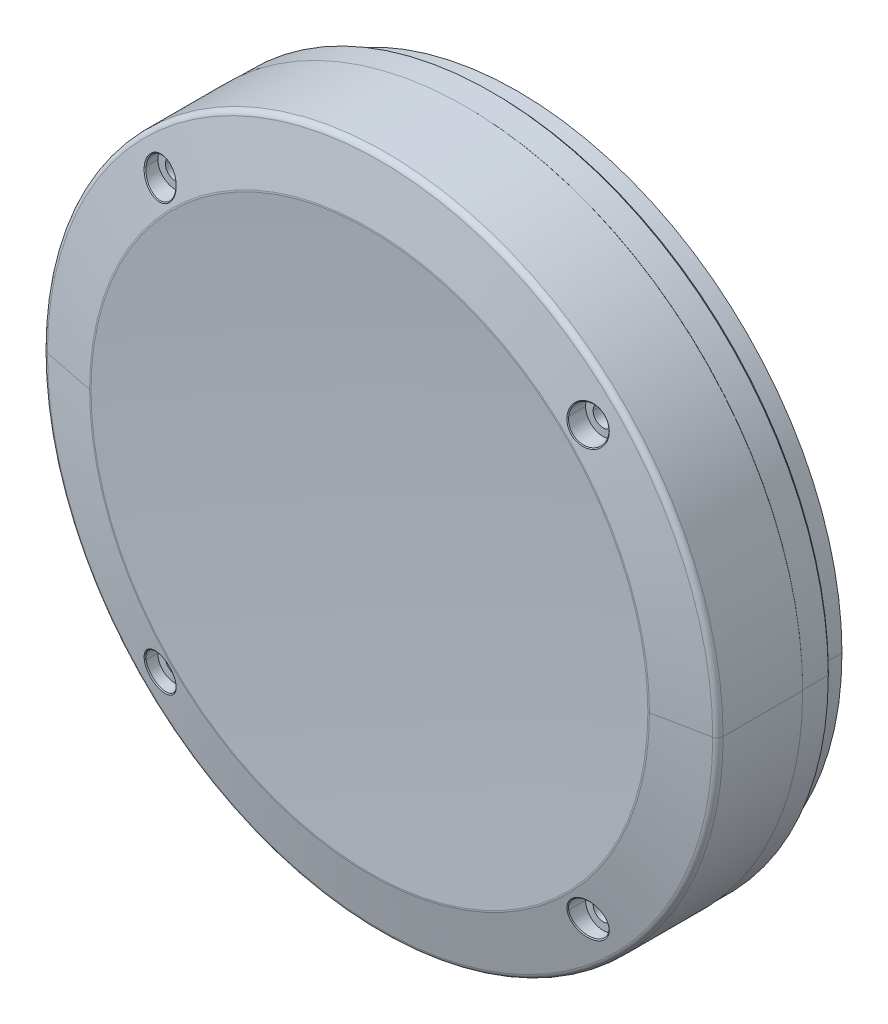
SolidWorks part; units mm, degrees
ref_plane "前视基准面" through (0, 0, 0) normal (0, 0, 1) x (1, 0, 0)
ref_plane "上视基准面" through (0, 0, 0) normal (0, 1, 0) x (1, 0, 0)
ref_plane "右视基准面" through (0, 0, 0) normal (1, 0, 0) x (0, 0, -1)
imported_body "8.0.00.8012658.STEP"
sketch "草图2" plane through (0, 0, 25.5) normal (0, 0, 1) x (1, 0, 0)
  line L0 (-35.1289, -7.4978) -> (-31.1029, -7.4978) construction
  line L1 (-31.1029, -7.4978) -> (-30.6943, -4.9026) construction
  line L2 (-30.6943, -4.9026) -> (-30.1382, -1.3698) construction
  line L3 (-30.1382, -1.3698) -> (-24.9084, -1.3698) construction
  line L4 (-24.9084, -1.3698) -> (-25.1466, -2.8586) construction
  line L5 (-25.1466, -2.8586) -> (-25.8781, -7.4978) construction
  line L6 (-25.8781, -7.4978) -> (-21.8313, -7.4978) construction
  line L7 (-21.8313, -7.4978) -> (-19.4531, 7.5063) construction
  line L8 (-19.4531, 7.5063) -> (-23.5003, 7.5063) construction
  line L9 (25.8241, -7.5156) -> (29.8995, -7.4978)
  line L10 (29.8995, -7.4978) -> (31.7217, 4.0224)
  line L11 (31.7217, 4.0224) -> (34.9295, 4.0224)
  line L12 (34.9295, 4.0224) -> (35.1162, 5.1621)
  line L13 (35.1162, 5.1621) -> (33.3616, 7.5063)
  line L14 (33.3616, 7.5063) -> (24.912, 7.5063)
  line L15 (24.912, 7.5063) -> (24.3389, 4.0224)
  line L16 (24.3389, 4.0224) -> (27.7004, 4.0224)
  line L17 (27.7004, 4.0224) -> (25.8241, -7.5156)
  line L18 (25.8241, -7.5156) -> (29.8995, -7.4978)
  line L19 (29.8995, -7.4978) -> (31.7217, 4.0224)
  line L20 (31.7217, 4.0224) -> (34.9295, 4.0224)
  line L21 (34.9295, 4.0224) -> (35.1162, 5.1621)
  line L22 (35.1162, 5.1621) -> (33.3616, 7.5063)
  line L23 (33.3616, 7.5063) -> (24.912, 7.5063)
  line L24 (24.912, 7.5063) -> (24.3389, 4.0224)
  line L25 (24.3389, 4.0224) -> (27.7004, 4.0224)
  line L26 (27.7004, 4.0224) -> (25.8241, -7.5156)
  line L27 (-23.5003, 7.5063) -> (-24.4126, 1.7152) construction
  line L28 (-24.4126, 1.7152) -> (-29.6586, 1.7152) construction
  line L29 (-29.6586, 1.7152) -> (-29.3947, 3.351) construction
  line L30 (-29.3947, 3.351) -> (-28.7253, 7.5063) construction
  line L31 (-28.7253, 7.5063) -> (-32.7607, 7.5063) construction
  line L32 (-32.7607, 7.5063) -> (-35.1289, -7.4978) construction
  line L33 (-20.6198, -7.4978) -> (-16.531, -7.4978) construction
  line L34 (-16.531, -7.4978) -> (-14.1566, 7.5063) construction
  line L35 (-14.1566, 7.5063) -> (-18.241, 7.5063) construction
  line L36 (-18.241, 7.5063) -> (-20.6198, -7.4978) construction
  line L37 (-0.1078, 7.5063) -> (-12.9818, 7.5063) construction
  line L38 (-12.9818, 7.5063) -> (-13.5555, 4.0224) construction
  line L39 (-13.5555, 4.0224) -> (-11.0726, 4.0224) construction
  line L40 (-11.0726, 4.0224) -> (-12.9039, -7.4962) construction
  line L41 (-12.9039, -7.4962) -> (-8.8727, -7.4978) construction
  line L42 (-8.8727, -7.4978) -> (-7.0501, 4.0224) construction
  line L43 (-7.0501, 4.0224) -> (-4.0626, 4.0224) construction
  line L44 (-4.0626, 4.0224) -> (-5.5783, -5.499) construction
  line L45 (-5.5783, -5.499) -> (-4.0815, -7.4978) construction
  line L46 (-4.0815, -7.4978) -> (-0.9476, -7.4978) construction
  line L47 (-35.1289, -7.4978) -> (-31.1029, -7.4978)
  line L48 (-31.1029, -7.4978) -> (-30.6943, -4.9026)
  line L49 (-30.6943, -4.9026) -> (-30.1382, -1.3698)
  line L50 (-30.1382, -1.3698) -> (-24.9084, -1.3698)
  line L51 (-24.9084, -1.3698) -> (-25.1466, -2.8586)
  line L52 (-25.1466, -2.8586) -> (-25.8781, -7.4978)
  line L53 (-25.8781, -7.4978) -> (-21.8313, -7.4978)
  line L54 (-21.8313, -7.4978) -> (-19.4531, 7.5063)
  line L55 (-19.4531, 7.5063) -> (-23.5003, 7.5063)
  line L56 (-23.5003, 7.5063) -> (-24.4126, 1.7152)
  line L57 (-24.4126, 1.7152) -> (-29.6586, 1.7152)
  line L58 (-29.6586, 1.7152) -> (-29.3947, 3.351)
  line L59 (-29.3947, 3.351) -> (-28.7253, 7.5063)
  line L60 (-28.7253, 7.5063) -> (-32.7607, 7.5063)
  line L61 (-32.7607, 7.5063) -> (-35.1289, -7.4978)
  line L62 (-20.6198, -7.4978) -> (-16.531, -7.4978)
  line L63 (-16.531, -7.4978) -> (-14.1566, 7.5063)
  line L64 (-14.1566, 7.5063) -> (-18.241, 7.5063)
  line L65 (-18.241, 7.5063) -> (-20.6198, -7.4978)
  line L66 (-0.1078, 7.5063) -> (-12.9818, 7.5063)
  line L67 (-12.9818, 7.5063) -> (-13.5555, 4.0224)
  line L68 (-13.5555, 4.0224) -> (-11.0726, 4.0224)
  line L69 (-11.0726, 4.0224) -> (-12.9039, -7.4962)
  line L70 (-12.9039, -7.4962) -> (-8.8727, -7.4978)
  line L71 (-8.8727, -7.4978) -> (-7.0501, 4.0224)
  line L72 (-7.0501, 4.0224) -> (-4.0626, 4.0224)
  line L73 (-4.0626, 4.0224) -> (-5.5783, -5.499)
  line L74 (-5.5783, -5.499) -> (-4.0815, -7.4978)
  line L75 (-4.0815, -7.4978) -> (-0.9476, -7.4978)
  arc A0 (18.4817, -5.4481) -> (13.7092, -5.4772) centre (19.2717, -526.5482) ccw construction
  arc A1 (18.4817, -5.4481) -> (13.7092, -5.4772) centre (19.2717, -526.5482) ccw
  spline S0 degree 3 poles (-2566.3608, 1539.9844) (1847.5228, -621.9763) (-901.2378, -809.9751) (-257.2526, 2948.9581) knots -79.496929 -79.496929 -79.496929 -79.496929 186.239084 186.239084 186.239084 186.239084 weights 1 1 1 1 only from (2.9549, 0.3089) to (5.2818, 1.484) construction
  spline S1 degree 3 poles (-2315.4188, 1884.8188) (143.3598, -687.4009) (1488.9575, -403.3626) (-2647.4347, 1392.6849) knots -108.91223 -108.91223 -108.91223 -108.91223 168.325963 168.325963 168.325963 168.325963 weights 1 1 1 1 only from (5.2818, 1.484) to (6.1272, 3.9392) construction
  spline S2 degree 3 poles (-119.1809, 2593.8462) (-2424.3959, -2732.2377) (2920.3443, 2163.3872) (-2588.1082, -1492.5466) knots -198.652553 -198.652553 -198.652553 -198.652553 173.115383 173.115383 173.115383 173.115383 weights 1 1 1 1 only from (6.1272, 3.9392) to (5.5784, 5.866) construction
  spline S3 degree 3 poles (-2225.7468, -1991.4067) (2816.5329, 1927.5131) (-2986.191, -1017.4619) (1860.3629, -1632.9942) knots -103.866914 -103.866914 -103.866914 -103.866914 262.712884 262.712884 262.712884 262.712884 weights 1 1 1 1 only from (5.5784, 5.866) to (4.0953, 7.086) construction
  spline S4 degree 3 poles (-2058.0278, -2169.7282) (1997.708, 2490.4781) (-1338.0055, -2713.3232) (-436.4881, 2807.3518) knots -141.852457 -141.852457 -141.852457 -141.852457 275.174163 275.174163 275.174163 275.174163 weights 1 1 1 1 only from (4.0953, 7.086) to (2.6927, 7.4154) construction
  spline S5 degree 3 poles (-1841.4606, 1611.6155) (-2872.6705, -1135.5815) (3567.0542, 748.0927) (-2964.6959, -446.5758) knots -183.968062 -183.968062 -183.968062 -183.968062 136.636924 136.636924 136.636924 136.636924 weights 1 1 1 1 only from (2.6927, 7.4154) to (-0.1078, 7.5063) construction
  spline S6 degree 3 poles (-2946.2437, 558.8956) (3561.3052, -883.5121) (-2830.8725, 1208.9153) (-2149.3906, -1323.571) knots -85.825272 -85.825272 -85.825272 -85.825272 213.288569 213.288569 213.288569 213.288569 weights 1 1 1 1 only from (-0.9476, -7.4978) to (2.3471, -7.3232) construction
  spline S7 degree 3 poles (75.9677, 2930.3993) (-1238.5529, -2156.602) (2184.1304, 1355.5474) (-2906.9843, -586.7676) knots -161.429444 -161.429444 -161.429444 -161.429444 177.768129 177.768129 177.768129 177.768129 weights 1 1 1 1 only from (2.3471, -7.3232) to (3.9907, -6.7397) construction
  spline S8 degree 3 poles (-1675.3939, 2473.5605) (1677.8306, -3194.0093) (-1105.5141, 3560.5162) (-613.3602, -2758.8447) knots -125.48733 -125.48733 -125.48733 -125.48733 231.059214 231.059214 231.059214 231.059214 weights 1 1 1 1 only from (3.9907, -6.7397) to (5.3893, -5.2138) construction
  spline S9 degree 3 poles (-2954.132, -449.4273) (2028.3065, 816.8848) (-690.873, -1532.2325) (-1113.1927, 2707.8529) knots -149.456813 -149.456813 -149.456813 -149.456813 190.286535 190.286535 190.286535 190.286535 weights 1 1 1 1 only from (5.3893, -5.2138) to (5.8965, -3.0905) construction
  spline S10 degree 3 poles (-2927.1463, -246.5308) (1138.8704, -1005.9772) (419.1822, 1865.7606) (-1727.8081, -2422.2511) knots -140.697677 -140.697677 -140.697677 -140.697677 134.95649 134.95649 134.95649 134.95649 weights 1 1 1 1 only from (5.8965, -3.0905) to (5.1448, -0.8315) construction
  spline S11 degree 3 poles (-2828.981, -840.5761) (1252.0511, -636.7793) (209.6272, 1748.6166) (-1517.6158, -2561.6626) knots -145.368212 -145.368212 -145.368212 -145.368212 133.339244 133.339244 133.339244 133.339244 weights 1 1 1 1 only from (5.1448, -0.8315) to (2.9549, 0.3089) construction
  spline S12 degree 3 poles (2698.4903, 1320.5985) (-2540.9289, -1572.2451) (2563.1607, 1565.9515) (-2677.0795, -1325.7329) knots 9.296295 9.296295 9.296295 9.296295 178.093239 178.093239 178.093239 178.093239 weights 1 1 1 1 only from (11.6967, -4.2382) to (9.4846, -0.2529) construction
  spline S13 degree 3 poles (1488.3923, -2609.5065) (-1337.9095, 2655.9954) (1214.3478, -2721.7452) (-1041.84, 2808.5678) knots 40.938987 40.938987 40.938987 40.938987 145.051334 145.051334 145.051334 145.051334 weights 1 1 1 1 only from (9.4846, -0.2529) to (9.506, 0.266) construction
  spline S14 degree 3 poles (2491.0231, -1674.9873) (-2638.2581, 1395.0975) (2658.9376, -1392.4562) (-2475.3151, 1672.0643) knots 9.316865 9.316865 9.316865 9.316865 169.911431 169.911431 169.911431 169.911431 weights 1 1 1 1 only from (9.506, 0.266) to (12.3024, 5.0501) construction
  spline S15 degree 3 poles (-1621.9326, -2509.1618) (1779.3083, 2385.6505) (-1916.9616, -2241.262) (2138.3403, 2119.4619) knots 41.545924 41.545924 41.545924 41.545924 137.16789 137.16789 137.16789 137.16789 weights 1 1 1 1 only from (12.3024, 5.0501) to (12.9927, 5.4336) construction
  spline S16 degree 3 poles (-369.8695, 2976.5866) (118.1142, -2964.469) (-88.5714, 2974.5767) (413.065, -2963.5978) knots -7.7443 -7.7443 -7.7443 -7.7443 182.461809 182.461809 182.461809 182.461809 weights 1 1 1 1 only from (12.9927, 5.4336) to (17.1413, 5.4126) construction
  spline S17 degree 3 poles (1235.5229, -2735.9559) (-1201.2076, 2751.3671) (1224.963, -2745.1326) (-1169.5726, 2760.553) knots 29.300877 29.300877 29.300877 29.300877 138.845601 138.845601 138.845601 138.845601 weights 1 1 1 1 only from (17.1413, 5.4126) to (17.3814, 5.5096) construction
  spline S18 degree 3 poles (-1230.7833, -2722.446) (1209.5375, 2618.5262) (-1183.7602, -2604.0351) (1292.7011, 2723.3905) knots 2.989527 2.989527 2.989527 2.989527 161.436184 161.436184 161.436184 161.436184 weights 1 1 1 1 only from (17.3814, 5.5096) to (18.5274, 7.4671) construction
  spline S19 degree 3 poles (2911.0041, 803.0559) (-2852.994, -818.6094) (2880.5996, 863.8797) (-2847.716, -878.9859) knots 9.410109 9.410109 9.410109 9.410109 154.679293 154.679293 154.679293 154.679293 weights 1 1 1 1 only from (18.5274, 7.4671) to (18.2466, 7.4853) construction
  spline S20 degree 3 poles (60.4686, -2984.6817) (342.2198, 3000.2287) (-305.6595, -2985.2889) (-37.3807, 2999.7298) knots -0.341981 -0.341981 -0.341981 -0.341981 158.319278 158.319278 158.319278 158.319278 weights 1 1 1 1 only from (18.2466, 7.4853) to (11.8094, 7.4914) construction
  spline S21 degree 3 poles (2860.4086, 943.1996) (-2729.5263, -1108.9841) (2663.3747, 1319.6854) (-2571.026, -1516.3797) knots 29.89182 29.89182 29.89182 29.89182 125.730802 125.730802 125.730802 125.730802 weights 1 1 1 1 only from (11.8094, 7.4914) to (11.1726, 7.1256) construction
  spline S22 degree 3 poles (-2692.8678, 1072.3431) (3425.3921, 127.9048) (-3546.6795, -419.7182) (2880.5397, -570.5262) knots -140.481268 -140.481268 -140.481268 -140.481268 319.688909 319.688909 319.688909 319.688909 weights 1 1 1 1 only from (11.1726, 7.1256) to (7.1844, 0.3226) construction
  spline S23 degree 3 poles (-12.1669, 2998.5739) (233.4204, -2954.3503) (-422.1943, 2932.4852) (635.1873, -2932.2949) knots 23.076667 23.076667 23.076667 23.076667 124.380409 124.380409 124.380409 124.380409 weights 1 1 1 1 only from (7.1844, 0.3226) to (7.1755, -0.303) construction
  spline S24 degree 3 poles (-2693.1727, -1237.029) (2348.7398, 1879.5075) (-2318.1813, -1907.2005) (2708.727, 1228.6971) knots -54.692035 -54.692035 -54.692035 -54.692035 202.917243 202.917243 202.917243 202.917243 weights 1 1 1 1 only from (7.1755, -0.303) to (11.1115, -7.3103) construction
  spline S25 degree 3 poles (-2378.1621, 1805.6211) (2465.8121, -1698.1345) (-2519.6905, 1566.4023) (2629.7401, -1470.0788) knots 16.549414 16.549414 16.549414 16.549414 124.211606 124.211606 124.211606 124.211606 weights 1 1 1 1 only from (11.1115, -7.3103) to (11.4102, -7.4857) construction
  spline S26 degree 3 poles (-446.705, -2970.7891) (309.9813, 2955.8928) (-286.1177, -2970.38) (480.426, 2954.3869) knots -18.124439 -18.124439 -18.124439 -18.124439 155.708082 155.708082 155.708082 155.708082 weights 1 1 1 1 only from (11.4102, -7.4857) to (14.0187, -7.4849) construction
  spline S27 degree 3 poles (30.2769, 2978.9792) (-494.7153, -2993.7849) (522.653, 2978.7928) (12.8483, -2993.8892) knots -57.026785 -57.026785 -57.026785 -57.026785 189.719307 189.719307 189.719307 189.719307 weights 1 1 1 1 only from (14.0187, -7.4849) to (19.5688, -7.4897) construction
  spline S28 degree 3 poles (-1628.7606, -2512.8493) (1534.5142, 2562.7833) (-1381.3577, -2642.7382) (1325.8697, 2692.7963) knots 6.591043 6.591043 6.591043 6.591043 121.260454 121.260454 121.260454 121.260454 weights 1 1 1 1 only from (19.5688, -7.4897) to (19.9071, -7.3087) construction
  spline S29 degree 3 poles (1109.9158, -2769.3629) (-1512.9191, 1949.4206) (1528.3723, -1951.5004) (-949.2059, 2798.6149) knots -96.373997 -96.373997 -96.373997 -96.373997 225.79148 225.79148 225.79148 225.79148 weights 1 1 1 1 only from (19.9071, -7.3087) to (24.0633, -0.2157) construction
  spline S30 degree 3 poles (-10.7823, -2998.4095) (-139.7035, 2963.6364) (383.0358, -2946.9498) (-526.2249, 2947.7914) knots -0.566965 -0.566965 -0.566965 -0.566965 122.373319 122.373319 122.373319 122.373319 weights 1 1 1 1 only from (24.0633, -0.2157) to (24.0662, 0.1989) construction
  spline S31 degree 3 poles (2676.9515, 1387.4227) (-2464.3189, -1681.7297) (2508.7459, 1688.9177) (-2628.3815, -1388.3365) knots -22.310822 -22.310822 -22.310822 -22.310822 140.922769 140.922769 140.922769 140.922769 weights 1 1 1 1 only from (24.0662, 0.1989) to (21.2713, 5.1855) construction
  spline S32 degree 3 poles (2803.2022, 1127.6785) (-2745.1468, -1143.1943) (2792.1382, 1142.1204) (-2775.1248, -1080.921) knots 5.450534 5.450534 5.450534 5.450534 108.693622 108.693622 108.693622 108.693622 weights 1 1 1 1 only from (21.2713, 5.1855) to (20.6696, 6.1925) construction
  spline S33 degree 3 poles (2476.3952, 1728.6463) (-2397.8649, -1580.3634) (2460.2896, 1554.5017) (-2505.9455, -1614.5206) knots -21.53227 -21.53227 -21.53227 -21.53227 134.266479 134.266479 134.266479 134.266479 weights 1 1 1 1 only from (20.6696, 6.1925) to (19.5712, 4.3268) construction
  spline S34 degree 3 poles (2262.2922, 1996.3837) (-2168.0913, -2038.1771) (2142.8622, 2111.9333) (-2029.7514, -2186.2218) knots 1.038591 1.038591 1.038591 1.038591 108.667619 108.667619 108.667619 108.667619 weights 1 1 1 1 only from (19.5712, 4.3268) to (19.5975, 3.9448) construction
  spline S35 degree 3 poles (-2111.6234, -2084.5888) (1865.4681, 2587.5473) (-1783.5372, -2632.4878) (2059.8439, 2183.9395) knots -121.800974 -121.800974 -121.800974 -121.800974 232.37933 232.37933 232.37933 232.37933 weights 1 1 1 1 only from (19.5975, 3.9448) to (21.6569, 0.2717) construction
  spline S36 degree 3 poles (2860.8853, 968.8022) (-2824.7474, -956.2887) (2868.2583, 956.3877) (-2817.8738, -967.4189) knots 10.053252 10.053252 10.053252 10.053252 89.102873 89.102873 89.102873 89.102873 weights 1 1 1 1 only from (21.6569, 0.2717) to (21.7304, -0.1938) construction
  spline S37 degree 3 poles (2768.6145, -1181.7914) (-2512.2063, 1544.7679) (2550.5157, -1553.3704) (-2729.2605, 1172.7818) knots -50.916119 -50.916119 -50.916119 -50.916119 148.85366 148.85366 148.85366 148.85366 weights 1 1 1 1 only from (21.7304, -0.1938) to (18.7384, -5.2865) construction
  spline S38 degree 3 poles (2991.2991, -405.9687) (-2929.6256, 500.285) (2950.8345, -601.3092) (-2904.9033, 666.9546) knots -14.70065 -14.70065 -14.70065 -14.70065 105.706777 105.706777 105.706777 105.706777 weights 1 1 1 1 only from (18.7384, -5.2865) to (18.4817, -5.4481) construction
  spline S39 degree 3 poles (2975.8301, 468.9461) (-2965.2318, -440.4255) (2999.7546, 374.9308) (-2970.1866, -313.3698) knots 3.768774 3.768774 3.768774 3.768774 84.61413 84.61413 84.61413 84.61413 weights 1 1 1 1 only from (13.7092, -5.4772) to (13.5884, -5.2186) construction
  spline S40 degree 3 poles (1326.4455, -2698.5126) (-1468.9238, 2443.7669) (1523.8597, -2442.6039) (-1386.2755, 2647.148) knots -99.446964 -99.446964 -99.446964 -99.446964 178.556941 178.556941 178.556941 178.556941 weights 1 1 1 1 only from (13.5884, -5.2186) to (14.9478, -2.9483) construction
  spline S41 degree 3 poles (-2399.2495, -1781.4861) (2512.9036, 1604.486) (-2580.9134, -1445.9049) (2724.0055, 1283.3166) knots -25.640128 -25.640128 -25.640128 -25.640128 104.315361 104.315361 104.315361 104.315361 weights 1 1 1 1 only from (14.9478, -2.9483) to (15.2626, -2.7713) construction
  spline S42 degree 3 poles (-47.3669, 2996.099) (-9.8112, -3002.0074) (41.7992, 2996.4547) (79.6365, -3001.6218) knots -37.907383 -37.907383 -37.907383 -37.907383 112.673045 112.673045 112.673045 112.673045 weights 1 1 1 1 only from (15.2626, -2.7713) to (16.8871, -2.7753) construction
  spline S43 degree 3 poles (-2705.7949, -1258.0069) (2611.9474, 1429.756) (-2466.4108, -1620.8908) (2405.8922, 1809.5167) knots -28.464249 -28.464249 -28.464249 -28.464249 99.55354 99.55354 99.55354 99.55354 weights 1 1 1 1 only from (16.8871, -2.7753) to (17.2492, -2.57) construction
  spline S44 degree 3 poles (2890.0619, -844.6437) (-3031.5188, 530.1495) (3083.9599, -486.6774) (-2885.247, 734.3014) knots -128.060039 -128.060039 -128.060039 -128.060039 201.679521 201.679521 201.679521 201.679521 weights 1 1 1 1 only from (17.2492, -2.57) to (18.6345, -0.2052) construction
  spline S45 degree 3 poles (-545.143, -2944.9911) (368.6888, 2943.7381) (-114.8763, -2960.9954) (-66.7261, 2997.0726) knots -31.620307 -31.620307 -31.620307 -31.620307 95.864619 95.864619 95.864619 95.864619 weights 1 1 1 1 only from (18.6345, -0.2052) to (18.6292, 0.2111) construction
  spline S46 degree 3 poles (2585.7836, 1551.8712) (-2513.4619, -1615.0569) (2550.181, 1616.3773) (-2549.8757, -1548.879) knots -33.9358 -33.9358 -33.9358 -33.9358 94.099509 94.099509 94.099509 94.099509 weights 1 1 1 1 only from (18.6292, 0.2111) to (17.844, 1.5996) construction
  spline S47 degree 3 poles (1734.4218, -2458.0024) (-1585.5842, 2517.4361) (1496.9245, -2587.1023) (-1325.5253, 2683.2003) knots -27.914597 -27.914597 -27.914597 -27.914597 86.471802 86.471802 86.471802 86.471802 weights 1 1 1 1 only from (17.844, 1.5996) to (17.8558, 2.0102) construction
  spline S48 degree 3 poles (-2506.5773, 1621.5026) (2487.3312, -1711.7188) (-2450.0705, 1718.3082) (2541.2869, -1618.9969) knots -46.182347 -46.182347 -46.182347 -46.182347 98.896074 98.896074 98.896074 98.896074 weights 1 1 1 1 only from (17.8558, 2.0102) to (18.9089, 3.7921) construction
  spline S49 degree 3 poles (-87.4736, -2991.5521) (-142.0349, 2949.8832) (440.2665, -2917.1615) (-655.3119, 2925.0982) knots -38.128736 -38.128736 -38.128736 -38.128736 86.724966 86.724966 86.724966 86.724966 weights 1 1 1 1 only from (18.9089, 3.7921) to (18.9355, 4.3506) construction
  spline S50 degree 3 poles (2009.9454, 2248.3216) (-1960.9477, -2265.4362) (1992.4731, 2280.1467) (-1953.8588, -2255.1581) knots -8.665517 -8.665517 -8.665517 -8.665517 53.788959 53.788959 53.788959 53.788959 weights 1 1 1 1 only from (18.9355, 4.3506) to (18.5933, 5.1241) construction
  spline S51 degree 3 poles (-1128.9978, -2766.5952) (1183.5824, 2784.1149) (-1142.9349, -2775.8306) (1151.4231, 2782.5241) knots -13.254973 -13.254973 -13.254973 -13.254973 55.848382 55.848382 55.848382 55.848382 weights 1 1 1 1 only from (18.5933, 5.1241) to (17.7422, 5.042) construction
  spline S52 degree 3 poles (2670.1028, 1401.4641) (-2467.5332, -1588.0623) (2357.1685, 1805.4908) (-2198.8295, -2013.8534) knots -45.597381 -45.597381 -45.597381 -45.597381 83.584228 83.584228 83.584228 83.584228 weights 1 1 1 1 only from (17.7422, 5.042) to (17.2924, 4.7515) construction
  spline S53 degree 3 poles (-2545.8755, 1562.2159) (2634.1695, -1461.6749) (-2601.6438, 1467.6892) (2582.0293, -1550.2062) knots -52.852138 -52.852138 -52.852138 -52.852138 87.748818 87.748818 87.748818 87.748818 weights 1 1 1 1 only from (17.2924, 4.7515) to (16.2531, 2.9615) construction
  spline S54 degree 3 poles (2936.8758, 680.9892) (-2917.9653, -470.5617) (2975.813, 291.3396) (-2980.5039, -119.8183) knots -44.689591 -44.689591 -44.689591 -44.689591 74.091163 74.091163 74.091163 74.091163 weights 1 1 1 1 only from (16.2531, 2.9615) to (15.8752, 2.7392) construction
  spline S55 degree 3 poles (38.6351, -2996.8482) (59.5633, 3002.7142) (-29.2537, -2997.2247) (-8.4687, 3002.3333) knots -46.864294 -46.864294 -46.864294 -46.864294 74.18265 74.18265 74.18265 74.18265 weights 1 1 1 1 only from (15.8752, 2.7392) to (14.3376, 2.7513) construction
  spline S56 degree 3 poles (2881.3382, 879.7981) (-2747.1562, -1067.9463) (2685.1953, 1280.1558) (-2583.2379, -1495.1089) knots -46.942227 -46.942227 -46.942227 -46.942227 71.176681 71.176681 71.176681 71.176681 weights 1 1 1 1 only from (14.3376, 2.7513) to (13.9043, 2.5105) construction
  spline S57 degree 3 poles (2589.5429, -1529.5341) (-2446.5236, 1738.6741) (2478.4301, -1726.7201) (-2567.2523, 1525.6973) knots -113.829442 -113.829442 -113.829442 -113.829442 129.724782 129.724782 129.724782 129.724782 weights 1 1 1 1 only from (13.9043, 2.5105) to (12.5635, 0.2248) construction
  spline S58 degree 3 poles (1159.513, 2770.7221) (-939.9309, -2809.1192) (760.0812, 2868.5042) (-519.7122, -2950.5634) knots -50.128435 -50.128435 -50.128435 -50.128435 67.944348 67.944348 67.944348 67.944348 weights 1 1 1 1 only from (12.5635, 0.2248) to (12.5651, -0.2739) construction
  spline S59 degree 3 poles (-2560.7506, -1541.8195) (2552.1161, 1602.8089) (-2526.4228, -1604.3228) (2586.9822, 1539.1996) knots -56.60861 -56.60861 -56.60861 -56.60861 69.228196 69.228196 69.228196 69.228196 weights 1 1 1 1 only from (12.5651, -0.2739) to (13.3342, -1.6365) construction
  spline S60 degree 3 poles (-2106.8906, 2120.2803) (2065.0033, -2178.0237) (-1958.7222, 2245.0682) (1894.3494, -2338.1597) knots -49.024981 -49.024981 -49.024981 -49.024981 60.37931 60.37931 60.37931 60.37931 weights 1 1 1 1 only from (13.3342, -1.6365) to (13.3168, -2.0463) construction
  spline S61 degree 3 poles (2629.3512, -1468.7767) (-2546.09, 1564.0902) (2571.1033, -1571.0209) (-2602.0013, 1466.0092) knots -93.089116 -93.089116 -93.089116 -93.089116 99.04582 99.04582 99.04582 99.04582 weights 1 1 1 1 only from (13.3168, -2.0463) to (12.4976, -3.4712) construction
  spline S62 degree 3 poles (-2025.9198, 2196.5748) (2105.7693, -2106.3037) (-2076.5425, 2102.6556) (2035.4583, -2218.1218) knots -137.433862 -137.433862 -137.433862 -137.433862 139.550836 139.550836 139.550836 139.550836 weights 1 1 1 1 only from (12.4976, -3.4712) to (11.9012, -4.4896) construction
  spline S63 degree 3 poles (2714.402, 1297.7184) (-2680.4595, -1327.4297) (2698.5588, 1329.6914) (-2674.9255, -1338.7969) knots 44.173622 44.173622 44.173622 44.173622 148.719237 148.719237 148.719237 148.719237 weights 1 1 1 1 only from (11.9012, -4.4896) to (11.6967, -4.2382) construction
  spline S64 degree 3 poles (2.9549, 0.3089) (3.9422, 0.4454) (4.7148, 0.8366) (5.2818, 1.484) knots 40.100612 40.100612 40.100612 40.100612 42.6069 42.6069 42.6069 42.6069 weights 1 1 1 1
  spline S65 degree 3 poles (5.2818, 1.484) (5.8443, 2.1274) (6.1272, 2.9461) (6.1272, 3.9392) knots 37.594324 37.594324 37.594324 37.594324 40.100612 40.100612 40.100612 40.100612 weights 1 1 1 1
  spline S66 degree 3 poles (6.1272, 3.9392) (6.1272, 4.6553) (5.9462, 5.2995) (5.5784, 5.866) knots 35.088035 35.088035 35.088035 35.088035 37.594324 37.594324 37.594324 37.594324 weights 1 1 1 1
  spline S67 degree 3 poles (5.5784, 5.866) (5.2147, 6.4326) (4.7181, 6.8383) (4.0953, 7.086) knots 32.581747 32.581747 32.581747 32.581747 35.088035 35.088035 35.088035 35.088035 weights 1 1 1 1
  spline S68 degree 3 poles (4.0953, 7.086) (3.7207, 7.244) (3.2523, 7.3523) (2.6927, 7.4154) knots 30.075459 30.075459 30.075459 30.075459 32.581747 32.581747 32.581747 32.581747 weights 1 1 1 1
  spline S69 degree 3 poles (2.6927, 7.4154) (2.1301, 7.4748) (1.1999, 7.5063) (-0.1078, 7.5063) knots 27.569171 27.569171 27.569171 27.569171 30.075459 30.075459 30.075459 30.075459 weights 1 1 1 1
  spline S70 degree 3 poles (-0.9476, -7.4978) (0.5913, -7.4978) (1.6856, -7.438) (2.3471, -7.3232) knots 12.531441 12.531441 12.531441 12.531441 15.037729 15.037729 15.037729 15.037729 weights 1 1 1 1
  spline S71 degree 3 poles (2.3471, -7.3232) (3.0038, -7.2084) (3.5534, -7.0121) (3.9907, -6.7397) knots 10.025153 10.025153 10.025153 10.025153 12.531441 12.531441 12.531441 12.531441 weights 1 1 1 1
  spline S72 degree 3 poles (3.9907, -6.7397) (4.5855, -6.3719) (5.0506, -5.8603) (5.3893, -5.2138) knots 7.518865 7.518865 7.518865 7.518865 10.025153 10.025153 10.025153 10.025153 weights 1 1 1 1
  spline S73 degree 3 poles (5.3893, -5.2138) (5.7288, -4.5631) (5.8965, -3.8567) (5.8965, -3.0905) knots 5.012576 5.012576 5.012576 5.012576 7.518865 7.518865 7.518865 7.518865 weights 1 1 1 1
  spline S74 degree 3 poles (5.8965, -3.0905) (5.8965, -2.1716) (5.6451, -1.4159) (5.1448, -0.8315) knots 2.506288 2.506288 2.506288 2.506288 5.012576 5.012576 5.012576 5.012576 weights 1 1 1 1
  spline S75 degree 3 poles (5.1448, -0.8315) (4.6409, -0.2512) (3.9099, 0.131) (2.9549, 0.3089) knots 0 0 0 0 2.506288 2.506288 2.506288 2.506288 weights 1 1 1 1
  spline S76 degree 3 poles (11.6967, -4.2382) (10.96, -2.9095) (10.2314, -1.5759) (9.4846, -0.2529) knots 93.128833 93.128833 93.128833 93.128833 94.954889 94.954889 94.954889 94.954889 weights 1 1 1 1
  spline S77 degree 3 poles (9.4846, -0.2529) (9.3714, -0.0516) (9.3969, 0.0826) (9.506, 0.266) knots 91.302777 91.302777 91.302777 91.302777 93.128833 93.128833 93.128833 93.128833 weights 1 1 1 1
  spline S78 degree 3 poles (9.506, 0.266) (10.4464, 1.8566) (11.3887, 3.4456) (12.3024, 5.0501) knots 89.476722 89.476722 89.476722 89.476722 91.302777 91.302777 91.302777 91.302777 weights 1 1 1 1
  spline S79 degree 3 poles (12.3024, 5.0501) (12.4754, 5.3528) (12.671, 5.4377) (12.9927, 5.4336) knots 87.650666 87.650666 87.650666 87.650666 89.476722 89.476722 89.476722 89.476722 weights 1 1 1 1
  spline S80 degree 3 poles (12.9927, 5.4336) (14.3756, 5.4158) (15.758, 5.4158) (17.1413, 5.4126) knots 85.824611 85.824611 85.824611 85.824611 87.650666 87.650666 87.650666 87.650666 weights 1 1 1 1
  spline S81 degree 3 poles (17.1413, 5.4126) (17.2286, 5.4126) (17.3235, 5.411) (17.3814, 5.5096) knots 83.998555 83.998555 83.998555 83.998555 85.824611 85.824611 85.824611 85.824611 weights 1 1 1 1
  spline S82 degree 3 poles (17.3814, 5.5096) (17.7564, 6.1529) (18.1334, 6.7947) (18.5274, 7.4671) knots 82.1725 82.1725 82.1725 82.1725 83.998555 83.998555 83.998555 83.998555 weights 1 1 1 1
  spline S83 degree 3 poles (18.5274, 7.4671) (18.4038, 7.4748) (18.3253, 7.4853) (18.2466, 7.4853) knots 80.346444 80.346444 80.346444 80.346444 82.1725 82.1725 82.1725 82.1725 weights 1 1 1 1
  spline S84 degree 3 poles (18.2466, 7.4853) (16.1015, 7.4845) (13.9549, 7.4744) (11.8094, 7.4914) knots 78.520389 78.520389 78.520389 78.520389 80.346444 80.346444 80.346444 80.346444 weights 1 1 1 1
  spline S85 degree 3 poles (11.8094, 7.4914) (11.491, 7.493) (11.3285, 7.3935) (11.1726, 7.1256) knots 76.694333 76.694333 76.694333 76.694333 78.520389 78.520389 78.520389 78.520389 weights 1 1 1 1
  spline S86 degree 3 poles (11.1726, 7.1256) (9.8535, 4.8517) (8.5236, 2.584) (7.1844, 0.3226) knots 74.868278 74.868278 74.868278 74.868278 76.694333 76.694333 76.694333 76.694333 weights 1 1 1 1
  spline S87 degree 3 poles (7.1844, 0.3226) (7.0502, 0.0939) (7.0421, -0.0686) (7.1755, -0.303) knots 73.042222 73.042222 73.042222 73.042222 74.868278 74.868278 74.868278 74.868278 weights 1 1 1 1
  spline S88 degree 3 poles (7.1755, -0.303) (8.4965, -2.6331) (9.8063, -4.9705) (11.1115, -7.3103) knots 71.216166 71.216166 71.216166 71.216166 73.042222 73.042222 73.042222 73.042222 weights 1 1 1 1
  spline S89 degree 3 poles (11.1115, -7.3103) (11.1875, -7.4493) (11.2546, -7.4865) (11.4102, -7.4857) knots 69.390111 69.390111 69.390111 69.390111 71.216166 71.216166 71.216166 71.216166 weights 1 1 1 1
  spline S90 degree 3 poles (11.4102, -7.4857) (12.2802, -7.476) (13.1487, -7.4849) (14.0187, -7.4849) knots 67.564055 67.564055 67.564055 67.564055 69.390111 69.390111 69.390111 69.390111 weights 1 1 1 1
  spline S91 degree 3 poles (14.0187, -7.4849) (15.8683, -7.4865) (17.7188, -7.4849) (19.5688, -7.4897) knots 65.738 65.738 65.738 65.738 67.564055 67.564055 67.564055 67.564055 weights 1 1 1 1
  spline S92 degree 3 poles (19.5688, -7.4897) (19.724, -7.4897) (19.821, -7.4574) (19.9071, -7.3087) knots 63.911944 63.911944 63.911944 63.911944 65.738 65.738 65.738 65.738 weights 1 1 1 1
  spline S93 degree 3 poles (19.9071, -7.3087) (21.2879, -4.9414) (22.674, -2.5781) (24.0633, -0.2157) knots 62.085889 62.085889 62.085889 62.085889 63.911944 63.911944 63.911944 63.911944 weights 1 1 1 1
  spline S94 degree 3 poles (24.0633, -0.2157) (24.1502, -0.0686) (24.1535, 0.0438) (24.0662, 0.1989) knots 60.259833 60.259833 60.259833 60.259833 62.085889 62.085889 62.085889 62.085889 weights 1 1 1 1
  spline S95 degree 3 poles (24.0662, 0.1989) (23.1302, 1.859) (22.2081, 3.5272) (21.2713, 5.1855) knots 58.433778 58.433778 58.433778 58.433778 60.259833 60.259833 60.259833 60.259833 weights 1 1 1 1
  spline S96 degree 3 poles (21.2713, 5.1855) (21.0834, 5.5177) (20.9238, 5.8701) (20.6696, 6.1925) knots 56.607722 56.607722 56.607722 56.607722 58.433778 58.433778 58.433778 58.433778 weights 1 1 1 1
  spline S97 degree 3 poles (20.6696, 6.1925) (20.293, 5.55) (19.9373, 4.9349) (19.5712, 4.3268) knots 54.781666 54.781666 54.781666 54.781666 56.607722 56.607722 56.607722 56.607722 weights 1 1 1 1
  spline S98 degree 3 poles (19.5712, 4.3268) (19.4835, 4.1801) (19.5203, 4.0798) (19.5975, 3.9448) knots 52.955611 52.955611 52.955611 52.955611 54.781666 54.781666 54.781666 54.781666 weights 1 1 1 1
  spline S99 degree 3 poles (19.5975, 3.9448) (20.2897, 2.7239) (20.9755, 1.4986) (21.6569, 0.2717) knots 51.129555 51.129555 51.129555 51.129555 52.955611 52.955611 52.955611 52.955611 weights 1 1 1 1
  spline S100 degree 3 poles (21.6569, 0.2717) (21.7328, 0.1335) (21.8508, 0.0098) (21.7304, -0.1938) knots 49.3035 49.3035 49.3035 49.3035 51.129555 51.129555 51.129555 51.129555 weights 1 1 1 1
  spline S101 degree 3 poles (21.7304, -0.1938) (20.7254, -1.8871) (19.7333, -3.5876) (18.7384, -5.2865) knots 47.477444 47.477444 47.477444 47.477444 49.3035 49.3035 49.3035 49.3035 weights 1 1 1 1
  spline S102 degree 3 poles (18.7384, -5.2865) (18.6794, -5.3883) (18.6212, -5.4473) (18.4817, -5.4481) knots 45.651389 45.651389 45.651389 45.651389 47.477444 47.477444 47.477444 47.477444 weights 1 1 1 1
  spline S103 degree 3 poles (13.7092, -5.4772) (13.438, -5.4797) (13.4893, -5.3811) (13.5884, -5.2186) knots 41.999278 41.999278 41.999278 41.999278 43.825333 43.825333 43.825333 43.825333 weights 1 1 1 1
  spline S104 degree 3 poles (13.5884, -5.2186) (14.0462, -4.4645) (14.5004, -3.7096) (14.9478, -2.9483) knots 40.173222 40.173222 40.173222 40.173222 41.999278 41.999278 41.999278 41.999278 weights 1 1 1 1
  spline S105 degree 3 poles (14.9478, -2.9483) (15.0258, -2.8174) (15.1118, -2.7697) (15.2626, -2.7713) knots 38.347167 38.347167 38.347167 38.347167 40.173222 40.173222 40.173222 40.173222 weights 1 1 1 1
  spline S106 degree 3 poles (15.2626, -2.7713) (15.8041, -2.7786) (16.3456, -2.7656) (16.8871, -2.7753) knots 36.521111 36.521111 36.521111 36.521111 38.347167 38.347167 38.347167 38.347167 weights 1 1 1 1
  spline S107 degree 3 poles (16.8871, -2.7753) (17.0609, -2.7778) (17.1619, -2.7212) (17.2492, -2.57) knots 34.695055 34.695055 34.695055 34.695055 36.521111 36.521111 36.521111 36.521111 weights 1 1 1 1
  spline S108 degree 3 poles (17.2492, -2.57) (17.7042, -1.778) (18.1673, -0.9899) (18.6345, -0.2052) knots 32.869 32.869 32.869 32.869 34.695055 34.695055 34.695055 34.695055 weights 1 1 1 1
  spline S109 degree 3 poles (18.6345, -0.2052) (18.723, -0.0556) (18.7194, 0.0599) (18.6292, 0.2111) knots 31.042944 31.042944 31.042944 31.042944 32.869 32.869 32.869 32.869 weights 1 1 1 1
  spline S110 degree 3 poles (18.6292, 0.2111) (18.3593, 0.6685) (18.1172, 1.1438) (17.844, 1.5996) knots 29.216889 29.216889 29.216889 29.216889 31.042944 31.042944 31.042944 31.042944 weights 1 1 1 1
  spline S111 degree 3 poles (17.844, 1.5996) (17.7495, 1.7572) (17.7701, 1.8663) (17.8558, 2.0102) knots 27.390833 27.390833 27.390833 27.390833 29.216889 29.216889 29.216889 29.216889 weights 1 1 1 1
  spline S112 degree 3 poles (17.8558, 2.0102) (18.211, 2.6018) (18.5488, 3.2047) (18.9089, 3.7921) knots 25.564778 25.564778 25.564778 25.564778 27.390833 27.390833 27.390833 27.390833 weights 1 1 1 1
  spline S113 degree 3 poles (18.9089, 3.7921) (19.0293, 3.9869) (19.0406, 4.1485) (18.9355, 4.3506) knots 23.738722 23.738722 23.738722 23.738722 25.564778 25.564778 25.564778 25.564778 weights 1 1 1 1
  spline S114 degree 3 poles (18.9355, 4.3506) (18.8022, 4.6076) (18.82, 5.0166) (18.5933, 5.1241) knots 21.912667 21.912667 21.912667 21.912667 23.738722 23.738722 23.738722 23.738722 weights 1 1 1 1
  spline S115 degree 3 poles (18.5933, 5.1241) (18.3722, 5.2291) (18.0316, 5.0651) (17.7422, 5.042) knots 20.086611 20.086611 20.086611 20.086611 21.912667 21.912667 21.912667 21.912667 weights 1 1 1 1
  spline S116 degree 3 poles (17.7422, 5.042) (17.5305, 5.0255) (17.3987, 4.9414) (17.2924, 4.7515) knots 18.260555 18.260555 18.260555 18.260555 20.086611 20.086611 20.086611 20.086611 weights 1 1 1 1
  spline S117 degree 3 poles (17.2924, 4.7515) (16.9558, 4.1485) (16.5941, 3.5605) (16.2531, 2.9615) knots 16.4345 16.4345 16.4345 16.4345 18.260555 18.260555 18.260555 18.260555 weights 1 1 1 1
  spline S118 degree 3 poles (16.2531, 2.9615) (16.1633, 2.8031) (16.066, 2.7327) (15.8752, 2.7392) knots 14.608444 14.608444 14.608444 14.608444 16.4345 16.4345 16.4345 16.4345 weights 1 1 1 1
  spline S119 degree 3 poles (15.8752, 2.7392) (15.3628, 2.7553) (14.85, 2.7319) (14.3376, 2.7513) knots 12.782389 12.782389 12.782389 12.782389 14.608444 14.608444 14.608444 14.608444 weights 1 1 1 1
  spline S120 degree 3 poles (14.3376, 2.7513) (14.1258, 2.7594) (14.0082, 2.6907) (13.9043, 2.5105) knots 10.956333 10.956333 10.956333 10.956333 12.782389 12.782389 12.782389 12.782389 weights 1 1 1 1
  spline S121 degree 3 poles (13.9043, 2.5105) (13.4659, 1.7435) (13.0218, 0.9797) (12.5635, 0.2248) knots 9.130278 9.130278 9.130278 9.130278 10.956333 10.956333 10.956333 10.956333 weights 1 1 1 1
  spline S122 degree 3 poles (12.5635, 0.2248) (12.4524, 0.0413) (12.4613, -0.0969) (12.5651, -0.2739) knots 7.304222 7.304222 7.304222 7.304222 9.130278 9.130278 9.130278 9.130278 weights 1 1 1 1
  spline S123 degree 3 poles (12.5651, -0.2739) (12.829, -0.7232) (13.0646, -1.1904) (13.3342, -1.6365) knots 5.478167 5.478167 5.478167 5.478167 7.304222 7.304222 7.304222 7.304222 weights 1 1 1 1
  spline S124 degree 3 poles (13.3342, -1.6365) (13.4307, -1.7974) (13.4, -1.9065) (13.3168, -2.0463) knots 3.652111 3.652111 3.652111 3.652111 5.478167 5.478167 5.478167 5.478167 weights 1 1 1 1
  spline S125 degree 3 poles (13.3168, -2.0463) (13.0384, -2.5183) (12.7712, -2.9968) (12.4976, -3.4712) knots 1.826056 1.826056 1.826056 1.826056 3.652111 3.652111 3.652111 3.652111 weights 1 1 1 1
  spline S126 degree 3 poles (12.4976, -3.4712) (12.3004, -3.8115) (12.1, -4.1493) (11.9012, -4.4896) knots 0 0 0 0 1.826056 1.826056 1.826056 1.826056 weights 1 1 1 1
  spline S127 degree 3 poles (11.9012, -4.4896) (11.7743, -4.4265) (11.7444, -4.3239) (11.6967, -4.2382) knots 94.954889 94.954889 94.954889 94.954889 96.780944 96.780944 96.780944 96.780944 weights 1 1 1 1
  dimension "D1" = 0
extrude "切除-拉伸1" cut sketch "草图2" against normal up to surface (1.1041 mm away)
